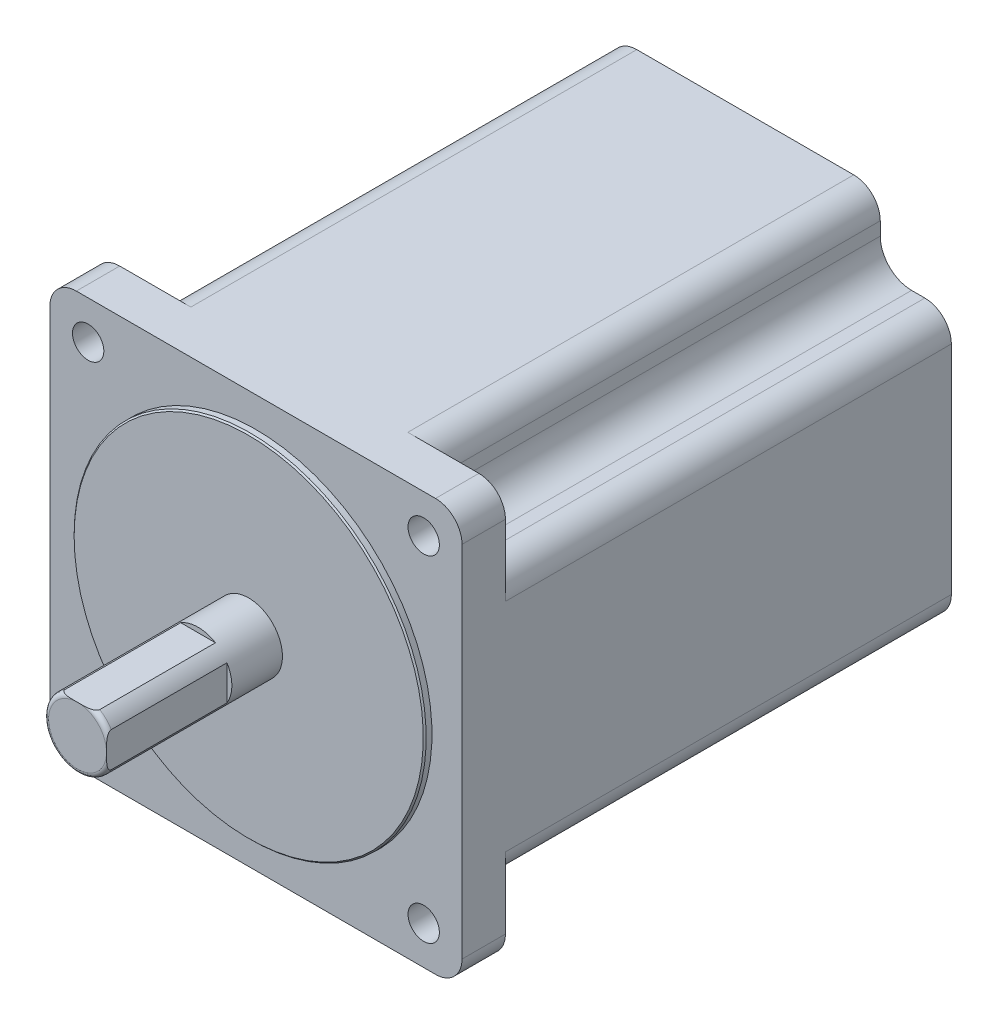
SolidWorks part; units mm, degrees
ref_plane "正面" through (0, 0, 0) normal (0, 0, 1) x (1, 0, 0)
ref_plane "平面" through (0, 0, 0) normal (0, 1, 0) x (1, 0, 0)
ref_plane "右側面" through (0, 0, 0) normal (1, 0, 0) x (0, 0, -1)
sketch "ｽｹｯﾁ1" plane through (0, 0, 0) normal (0, 0, 1) x (1, 0, 0)
  circle A0 centre (0, 0) radius 7
  dimension "D1" = 14
extrude "押し出し1" add sketch "ｽｹｯﾁ1" along normal blind 35.5
sketch "ｽｹｯﾁ2" plane through (0, 0, 0) normal (0, 0, -1) x (-1, 0, 0)
  circle A0 centre (0, 0) radius 36.5125
  dimension "D1" = 73.025
extrude "押し出し2" add sketch "ｽｹｯﾁ2" along normal blind 1.5
sketch "ｽｹｯﾁ3" plane through (0, 0, -1.5) normal (0, 0, -1) x (-1, 0, 0)
  line L1 (-42.75, 42.75) -> (42.75, 42.75)
  line L2 (-42.75, 42.75) -> (-42.75, -42.75)
  line L3 (-42.75, -42.75) -> (42.75, -42.75)
  line L4 (42.75, 42.75) -> (42.75, -42.75)
  line L5 (-42.75, 42.75) -> (42.75, -42.75) construction
  line L6 (-42.75, -42.75) -> (42.75, 42.75) construction
  line L7 (34.8, 34.8) -> (-34.8, 34.8) construction
  line L8 (34.8, 34.8) -> (34.8, -34.8) construction
  line L9 (34.8, -34.8) -> (-34.8, -34.8) construction
  line L10 (-34.8, 34.8) -> (-34.8, -34.8) construction
  line L11 (34.8, 34.8) -> (-34.8, -34.8) construction
  line L12 (34.8, -34.8) -> (-34.8, 34.8) construction
  circle A0 centre (34.8, 34.8) radius 3.25
  circle A1 centre (-34.8, 34.8) radius 3.25
  circle A2 centre (34.8, -34.8) radius 3.25
  circle A3 centre (-34.8, -34.8) radius 3.25
  point P0 (0, 0)
  point P6 (0, 0)
  dimension "D3" = 69.6
  dimension "D4" = 69.6
  dimension "D6" = 6.5
  dimension "D1" = 85.5
  dimension "D2" = 85.5
extrude "押し出し3" add sketch "ｽｹｯﾁ3" along normal blind 9
fillet "Fillet1" radius 5.5 4 edges at (42.75, -42.75, -6) (-42.75, -42.75, -6) (-42.75, 42.75, -6) (42.75, 42.75, -6)
sketch "ｽｹｯﾁ4" plane through (0, 0, -10.5) normal (0, 0, -1) x (-1, 0, 0)
  line L0 (28, 28) -> (42.75, 28)
  line L1 (-28, 42.75) -> (28, 42.75)
  line L2 (-28, 42.75) -> (-28, 28)
  line L3 (-28, -42.75) -> (28, -42.75)
  line L4 (28, 42.75) -> (28, 28)
  line L5 (-28, 42.75) -> (28, -42.75) construction
  line L6 (-28, -42.75) -> (28, 42.75) construction
  line L7 (-42.75, 28) -> (-28, 28)
  line L8 (-42.75, 28) -> (-42.75, -28)
  line L9 (-42.75, -28) -> (-28, -28)
  line L10 (42.75, 28) -> (42.75, -28)
  line L11 (-42.75, 28) -> (42.75, -28) construction
  line L12 (-42.75, -28) -> (42.75, 28) construction
  line L13 (-28, -28) -> (-28, -42.75)
  line L14 (28, -28) -> (42.75, -28)
  line L15 (28, -28) -> (28, -42.75)
  point P0 (0, 0)
  point P6 (0, 0)
  dimension "D1" = 56
  dimension "D2" = 85.5
  dimension "D3" = 85.5
  dimension "D4" = 56
extrude "押し出し4" add sketch "ｽｹｯﾁ4" along normal blind 92.5
fillet "Fillet2" radius 6.5 4 edges at (28, -28, -56.75) (-28, -28, -56.75) (-28, 28, -56.75) (28, 28, -56.75)
fillet "Fillet3" radius 5.5 8 edges
sketch "Sketch1" plane through (0, -42.75, 0) normal (0, -1, 0) x (1, 0, 0)
  line L0 (22.5, -103) -> (-22.5, -103) construction
  line L1 (-13.25, -103) -> (13.25, -103)
  line L2 (-13.25, -103) -> (-13.25, -82)
  line L3 (-13.25, -82) -> (13.25, -82)
  line L4 (13.25, -103) -> (13.25, -82)
  dimension "D1" = 21
  dimension "D2" = 26.5
  dimension "D3" = 13.25
extrude "Extrude1" add sketch "Sketch1" along normal blind 12
sketch "Sketch5" plane through (13.25, 0, 0) normal (1, 0, 0) x (0, 0, -1)
  line L0 (103, -47.75) -> (94.4, -54.75)
  line L3 (103, -54.75) -> (103, -42.75) construction
  line L4 (103, -54.75) -> (82, -54.75) construction
  line L6 (94.4, -54.75) -> (103, -54.75)
  line L8 (103, -54.75) -> (103, -47.75)
  dimension "D1" = 7
  dimension "D2" = 8.6
extrude "Extrude4" cut sketch "Sketch5" against normal through all and the other way through all
sketch "Sketch6" plane through (0, 0, -82) normal (0, 0, 1) x (1, 0, 0)
  line L0 (-13.25, -49.75) -> (-13.25, -54.75)
  line L2 (-13.25, -49.75) -> (-13.25, -54.75)
  line L3 (-13.25, -54.75) -> (-7.5, -54.75)
  line L4 (13.25, -54.75) -> (-13.25, -54.75) construction
  line L5 (-7.5, -54.75) -> (-13.25, -49.75)
  line L6 (13.25, -49.75) -> (13.25, -54.75)
  line L7 (13.25, -54.75) -> (13.25, -42.75) construction
  line L8 (13.25, -54.75) -> (7.5, -54.75)
  line L9 (7.5, -54.75) -> (13.25, -49.75)
  dimension "D1" = 5
  dimension "D2" = 7.5
  dimension "D3" = 15
  dimension "D4" = 5
extrude "Extrude5" cut sketch "Sketch6" against normal through all contours L5 M3 M2 | L9 M3 M4
fillet "Fillet4" radius 1 1 edges at (7, 0, 35.5)
sketch "Sketch2" plane through (0, 0, 35.5) normal (0, 0, 1) x (1, 0, 0)
  line L1 (-7, 8) -> (7, 8)
  line L2 (-7, 8) -> (-7, 6)
  line L3 (-7, 6) -> (7, 6)
  line L4 (7, 8) -> (7, 6)
  line L5 (8, -8) -> (6, -8)
  line L6 (8, -8) -> (8, 6)
  line L7 (8, 6) -> (6, 6)
  line L8 (6, -8) -> (6, 6)
  circle A0 centre (0, 0) radius 7 construction
  dimension "D1" = 6
  dimension "D2" = 14
  dimension "D3" = 2
  dimension "D4" = 7
  dimension "D5" = 6
  dimension "D6" = 2
  dimension "D7" = 14
extrude "Extrude2" cut sketch "Sketch2" against normal blind 25 contours L4 L1 L2 L3 | L6 L7 L8 L5
chamfer "Chamfer2" distance 0.3 angle 45 1 edges at (-36.5125, 0, 0)
sketch "Sketch3" plane through (0, 0, -1.5) normal (0, 0, 1) x (1, 0, 0)
  circle A0 centre (0, 0) radius 18
  circle A1 centre (0, 0) radius 24.35
  dimension "D1" = 48.7
  dimension "D2" = 36
extrude "Extrude3" cut sketch "Sketch3" against normal blind 0.2
chamfer "Chamfer3" distance 0.2 distance2 0.4 1 edges at (24.35, 0, -1.7)
